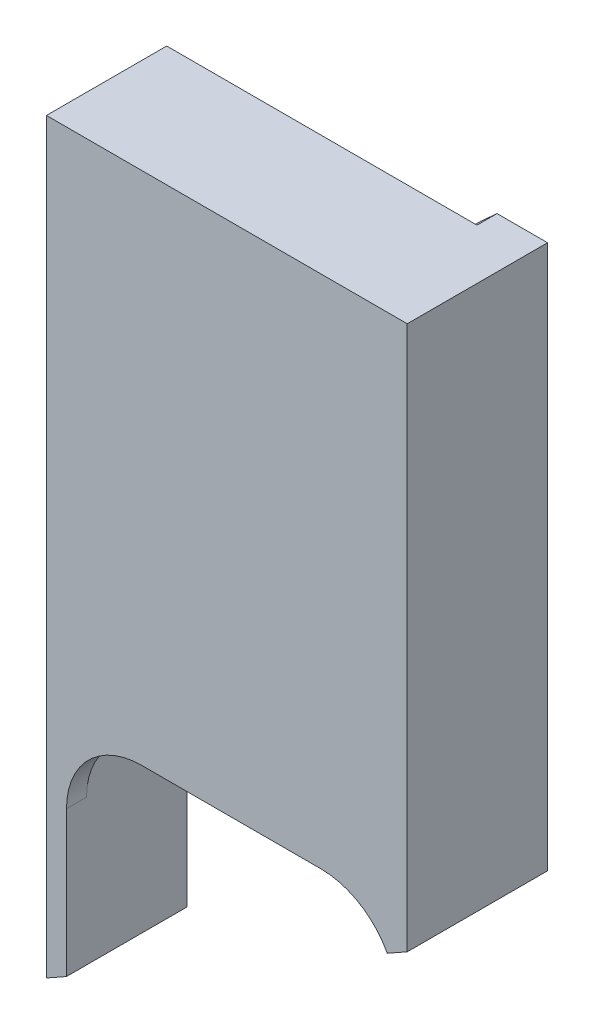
SolidWorks part; units mm, degrees
ref_plane "Front Plane" through (0, 0, 0) normal (0, 0, 1) x (1, 0, 0)
ref_plane "Top Plane" through (0, 0, 0) normal (0, 1, 0) x (1, 0, 0)
ref_plane "Right Plane" through (0, 0, 0) normal (1, 0, 0) x (0, 0, -1)
sketch "Sketch1" plane through (0, 0, 0) normal (1, 0, 0) x (0, 0, -1)
  line L10 (1.27, 0) -> (1.27, -34.29)
  line L11 (1.27, -34.29) -> (3.175, -34.29)
  line L12 (3.175, -34.29) -> (3.175, -57.15)
  line L13 (3.175, -57.15) -> (1.27, -57.15)
  line L14 (1.27, -57.15) -> (1.27, -107.95)
  line L15 (1.27, -107.95) -> (-1.27, -107.95)
  line L24 (0, -107.95) -> (0, 0) construction
  line L25 (-1.27, 0) -> (-1.27, -107.95)
  line L32 (-1.27, 0) -> (1.27, 0)
  dimension "D1" = 2.54
  dimension "D2" = 1.905
  dimension "D7" = 34.29
  dimension "D8" = 22.86
  dimension "D9" = 50.8
extrude "Boss-Extrude1" add sketch "Sketch1" along normal mid plane 45.72
sketch "Sketch2" plane through (0, 0, -1.27) normal (0, 0, -1) x (-1, 0, 0)
  line L0 (-22.86, -107.95) -> (-22.86, 0)
  line L1 (-22.86, 0) -> (22.86, 0)
  line L2 (22.86, 0) -> (22.86, -107.95)
  line L3 (22.86, -107.95) -> (20.32, -107.95)
  line L4 (-22.86, -107.95) -> (22.86, -107.95) construction
  line L5 (20.32, -107.95) -> (20.32, -2.54)
  line L6 (20.32, -2.54) -> (-20.32, -2.54)
  line L7 (-20.32, -2.54) -> (-20.32, -107.95)
  line L8 (-20.32, -107.95) -> (-22.86, -107.95)
  dimension "D1" = 2.54
  dimension "D2" = 2.54
extrude "Boss-Extrude2" add sketch "Sketch2" along normal blind 12.7
sketch "Sketch4" plane through (0, 0, -13.97) normal (0, 0, -1) x (-1, 0, 0)
  line L0 (-20.32, -107.95) -> (-22.86, -107.95)
  line L1 (-22.86, -107.95) -> (-22.86, 0)
  line L4 (-20.32, -107.95) -> (-8.2997, -65.3161)
  line L5 (-22.86, 0) -> (-16.4584, 0)
  line L6 (22.86, 0) -> (-22.86, 0) construction
  arc A2 (-8.2997, -65.3161) -> (-16.4584, 0) centre (-48.26, -37.14) ccw
  circle A4 centre (-48.26, -37.14) radius 48.895 construction
extrude "Boss-Extrude4" add sketch "Sketch4" along normal blind 2.54
sketch "Sketch10" plane through (0, 0, 1.27) normal (0, 0, 1) x (1, 0, 0)
  line L0 (-22.86, -107.95) -> (-22.86, -94.6582)
  line L1 (-22.86, 0) -> (-22.86, -107.95) construction
  line L2 (-22.86, -94.6582) -> (22.86, -68.9255)
  line L3 (22.86, 0) -> (22.86, -107.95) construction
  line L4 (22.86, -68.9255) -> (22.86, -107.95)
  line L5 (22.86, -107.95) -> (-22.86, -107.95)
  line L7 (-4.3633, -84.2476) -> (12.1802, -74.9365) construction
extrude "Cut-Extrude3" cut sketch "Sketch10" against normal through all
sketch "Sketch12" plane through (0, 0, -1.27) normal (0, 0, -1) x (-1, 0, 0)
  line L0 (20.32, -93.2286) -> (20.32, -65.2886)
  line L1 (20.32, -65.2886) -> (-20.32, -65.2886)
  line L2 (-20.32, -65.2886) -> (-20.32, -70.3551)
  line L3 (-20.32, -70.3551) -> (20.32, -93.2286)
  dimension "D1" = 27.94
extrude "Cut-Extrude5" cut sketch "Sketch12" against normal through all
sketch "Sketch5" [suppressed] plane through (0, 0, -16.51) normal (0, 0, -1) x (-1, 0, 0)
  line L3 (-22.86, -68.9255) -> (-11.172, -75.5039)
  line L4 (-22.86, -68.9255) -> (-11.172, -75.5039)
  line L6 (-16.4584, 0) -> (-22.86, 0)
  line L7 (-16.4584, 0) -> (-22.86, 0)
  line L8 (-11.172, -75.5039) -> (-8.2997, -65.3161)
  line L10 (-22.86, 0) -> (-22.86, -68.9255)
  line L12 (-11.172, -75.5039) -> (-8.2997, -65.3161)
  line L14 (-22.86, 0) -> (-22.86, -68.9255)
  arc A2 (-8.2997, -65.3161) -> (-16.4584, 0) centre (-48.26, -37.14) ccw
  arc A3 (-8.2997, -65.3161) -> (-16.4584, 0) centre (-48.26, -37.14) ccw
  dimension "D1" = 0
extrude "Cut-Extrude1" [suppressed] cut sketch "Sketch5" against normal up to surface (2.54 mm away)
mirror "Mirror1" [suppressed] about plane through (0, 0, 0) normal (1, 0, 0)
mirror "Mirror2" [suppressed]
sketch "Sketch11" [suppressed] plane through (0, 0, 1.27) normal (0, 0, 1) x (1, 0, 0)
  line L0 (-22.86, 0) -> (-22.86, -94.6582)
  line L1 (-22.86, -94.6582) -> (22.86, -68.9255)
  line L2 (22.86, -68.9255) -> (22.86, 0)
  line L3 (68.58, 0) -> (-22.86, 0) construction
  line L4 (22.86, 0) -> (-22.86, 0)
extrude "Cut-Extrude4" [suppressed] cut sketch "Sketch11" against normal through all
ref_plane "Plane1" [suppressed] through (45.72, 0, 0) normal (1, 0, 0) x (0, 0, -1)
fillet "Fillet1" radius 9.525 2 edges at (20.32, -65.2886, 0) (-20.32, -65.2886, 0)
